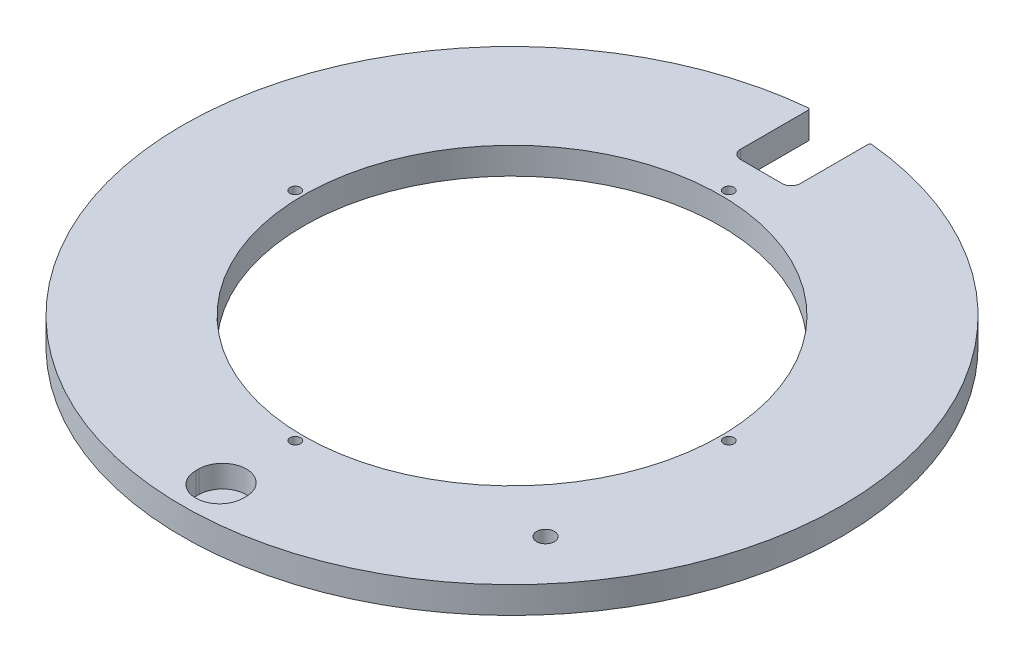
SolidWorks part; units mm, degrees
ref_plane "FRONT" through (0, 0, 0) normal (0, 0, 1) x (1, 0, 0)
ref_plane "TOP" through (0, 0, 0) normal (0, 1, 0) x (1, 0, 0)
ref_plane "RIGHT" through (0, 0, 0) normal (1, 0, 0) x (0, 0, -1)
ref_plane "PlateCamTopPlane" through (0, 1219.2, 0) normal (0, 1, 0) x (-1, 0, 0)
sketch "Sketch1" plane through (0, 1219.2, 0) normal (0, 1, 0) x (-1, 0, 0)
  circle A0 centre (0, 0) radius 111.5219
  circle A1 centre (0, 0) radius 176.2125
  dimension "D1" = 223.0437
  dimension "D2" = 352.425
extrude "Base-Extrude" add sketch "Sketch1" against normal blind 5.5562
ref_plane "PlateCamMiddlePlane" through (0, 1213.6438, 0) normal (0, 1, 0) x (-1, 0, 0)
sketch "Sketch2" plane through (0, 1213.6438, 0) normal (0, 1, 0) x (-1, 0, 0)
  circle A0 centre (0, 0) radius 176.2125 construction
  circle A1 centre (0, 0) radius 176.2125
  circle A2 centre (0, 0) radius 111.5219 construction
  circle A3 centre (0, 0) radius 111.5219
extrude "Boss-Extrude1" add sketch "Sketch2" against normal blind 8.7312
sketch "Sketch3" plane through (0, 1219.2, 0) normal (0, 1, 0) x (1, 0, 0)
  line L0 (-41.6094, 0) -> (41.6094, 0) construction
  line L1 (0, 0) -> (0, -193.5564) construction
  line L2 (12.719, -154.7813) -> (12.719, -156.3688)
  line L3 (-12.7191, -154.7812) -> (-12.7191, -156.3687)
  circle A0 centre (0, 0) radius 156.3688 construction
  arc A1 (12.719, -154.7813) -> (-12.7191, -154.7812) centre (0, -154.7812) ccw
  arc A2 (-12.7191, -156.3687) -> (12.719, -156.3688) centre (0, -156.3688) ccw
  dimension "D2" = 312.7375
  dimension "D4" = 25.4381
  dimension "D1" = 270
  dimension "D3" = 1.5875
extrude "anri-rot slot" cut sketch "Sketch3" against normal blind 11.9062
sketch "Sketch4" plane through (125.112, 1219.2, -3.7572) normal (0, 1, 0) x (-1, 0, 0)
  point P0 (9.2245, 3.7572)
sketch "Sketch5" plane through (115.8875, 1219.2, 0) normal (1, 0, 0) x (0, 0, 1)
  line L0 (0, 0) -> (0, 203.2)
  line L1 (0, 203.2) -> (2.8067, 203.2)
  line L2 (2.8067, 203.2) -> (2.8067, 0)
  line L3 (2.8067, 0) -> (0, 0)
  line L4 (0, 110) -> (0, -10) construction
  dimension "Diameter" = 5.6134
  dimension "Depth" = 203.2
hole_wizard "10-OV-DR1" positions "Sketch4" profile "Sketch5" legacy
sketch "Sketch6" plane through (14.7803, 1219.2, 118.1786) normal (0, 1, 0) x (-1, 0, 0)
  point P0 (14.7803, -2.2911)
sketch "Sketch7" plane through (0, 1219.2, 115.8875) normal (1, 0, 0) x (0, 0, 1)
  line L0 (0, 0) -> (0, 203.2)
  line L1 (0, 203.2) -> (2.8067, 203.2)
  line L2 (2.8067, 203.2) -> (2.8067, 0)
  line L3 (2.8067, 0) -> (0, 0)
  line L4 (0, 110) -> (0, -10) construction
  dimension "Diameter" = 5.6134
  dimension "Depth" = 203.2
hole_wizard "10-OV-DR2" positions "Sketch6" profile "Sketch7" legacy
sketch "Sketch8" plane through (-106.8847, 1219.2, 8.3042) normal (0, 1, 0) x (-1, 0, 0)
  point P0 (9.0028, -8.3042)
sketch "Sketch9" plane through (-115.8875, 1219.2, 0) normal (1, 0, 0) x (0, 0, 1)
  line L0 (0, 0) -> (0, 203.2)
  line L1 (0, 203.2) -> (2.8067, 203.2)
  line L2 (2.8067, 203.2) -> (2.8067, 0)
  line L3 (2.8067, 0) -> (0, 0)
  line L4 (0, 110) -> (0, -10) construction
  dimension "Diameter" = 5.6134
  dimension "Depth" = 203.2
hole_wizard "10-OV-DR3" positions "Sketch8" profile "Sketch9" legacy
sketch "Sketch10" plane through (1.9411, 1219.2, -114.0973) normal (0, 1, 0) x (-1, 0, 0)
  point P0 (1.9411, -1.7902)
sketch "Sketch11" plane through (0, 1219.2, -115.8875) normal (1, 0, 0) x (0, 0, 1)
  line L0 (0, 0) -> (0, 203.2)
  line L1 (0, 203.2) -> (2.8067, 203.2)
  line L2 (2.8067, 203.2) -> (2.8067, 0)
  line L3 (2.8067, 0) -> (0, 0)
  line L4 (0, 110) -> (0, -10) construction
  dimension "Diameter" = 5.6134
  dimension "Depth" = 203.2
hole_wizard "10-OV-DR4" positions "Sketch10" profile "Sketch11" legacy
sketch "DIAL ALIGN SKETCH" plane through (0, 0, 0) normal (0, 1, 0) x (1, 0, 0)
  line L0 (-44.3157, 0) -> (44.3157, 0) construction
  line L1 (0, 0) -> (111.2727, -93.3689) construction
  dimension "D1" = 320
  dimension "D2" = 145.2562
sketch "Sketch19" plane through (134.2386, 1204.9125, 96.5416) normal (0, -1, 0) x (1, 0, 0)
  point P0 (-22.9659, -3.1727)
sketch "Sketch20" plane through (111.2727, 1204.9125, 93.3689) normal (1, 0, 0) x (0, 0, -1)
  line L0 (0, 0) -> (0, 203.2)
  line L1 (0, 203.2) -> (5.1594, 203.2)
  line L2 (5.1594, 203.2) -> (5.1594, 19.05)
  line L3 (5.1594, 19.05) -> (4.7689, 19.05)
  line L4 (4.7689, 19.05) -> (4.7689, 0)
  line L5 (4.7689, 0) -> (0, 0)
  line L6 (0, 110) -> (0, -10) construction
  dimension "Diameter" = 10.3187
  dimension "Depth" = 203.2
  dimension "C-Bore Diameter" = 9.5377
  dimension "C-Bore Depth" = 19.05
hole_wizard "Hole7" positions "Sketch19" profile "Sketch20" legacy
sketch "Sketch22" plane through (0, 0, 0) normal (0, 1, 0) x (1, 0, 0)
  line L0 (-50, 0) -> (50, 0) construction
  line L1 (-15.9258, 184.15) -> (15.9258, 184.15)
  line L2 (-15.9258, 184.15) -> (-15.9258, 138.1125)
  line L3 (-11.1633, 133.35) -> (11.1633, 133.35)
  line L4 (15.9258, 184.15) -> (15.9258, 138.1125)
  line L5 (0, 0) -> (42.7872, 0) construction
  line L6 (0, 0) -> (0, 236.9762) construction
  arc A0 (-11.1633, 133.35) -> (-15.9258, 138.1125) centre (-11.1633, 138.1125) cw
  arc A1 (15.9258, 138.1125) -> (11.1633, 133.35) centre (11.1633, 138.1125) cw
  point P10 (0, 133.35)
  dimension "D4" = 4.7625
  dimension "D1" = 133.35
  dimension "D2" = 50.8
  dimension "D3" = 90
  dimension "D5" = 15.9258
extrude "Cut-Extrude2" cut sketch "Sketch22" along normal through all
chamfer "Chamfer1" distance 0.7937 angle 45 2 edges at (-15.9258, 1212.0563, -175.4914) (15.9258, 1212.0563, -175.4914)
